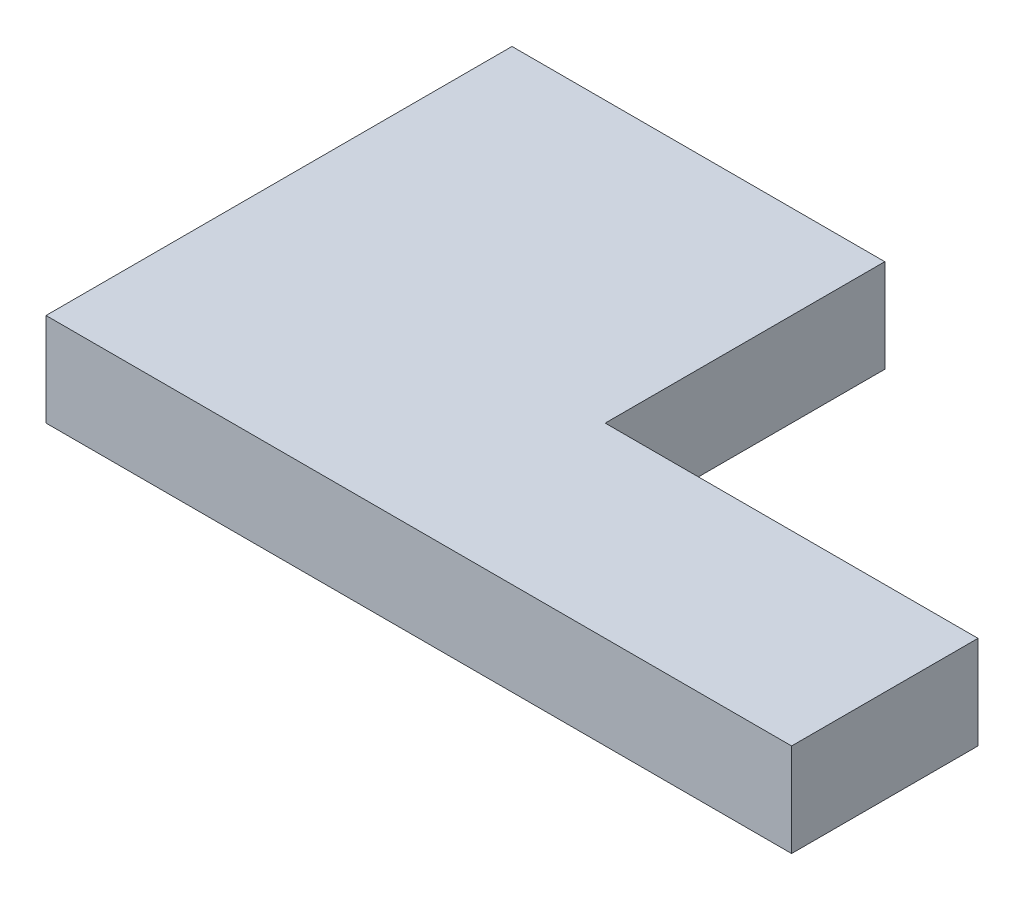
SolidWorks part; units mm, degrees
ref_plane "Front Plane" through (0, 0, 0) normal (0, 0, 1) x (1, 0, 0)
ref_plane "Top Plane" through (0, 0, 0) normal (0, 1, 0) x (1, 0, 0)
ref_plane "Right Plane" through (0, 0, 0) normal (1, 0, 0) x (0, 0, -1)
sketch "Sketch1" plane through (0, 0, 0) normal (0, -1, 0) x (1, 0, 0)
  line L1 (0, 0) -> (200, 0)
  line L2 (0, 0) -> (0, -125)
  line L3 (0, -125) -> (100, -125)
  line L6 (200, -50) -> (100, -50)
  line L7 (100, -125) -> (100, -50)
  line L10 (200, -50) -> (200, 0)
  point P0 (0, 0)
  dimension "D1" = 200
  dimension "D2" = 50
  dimension "D3" = 125
  dimension "D4" = 100
extrude "Boss-Extrude1" add sketch "Sketch1" against normal blind 25
